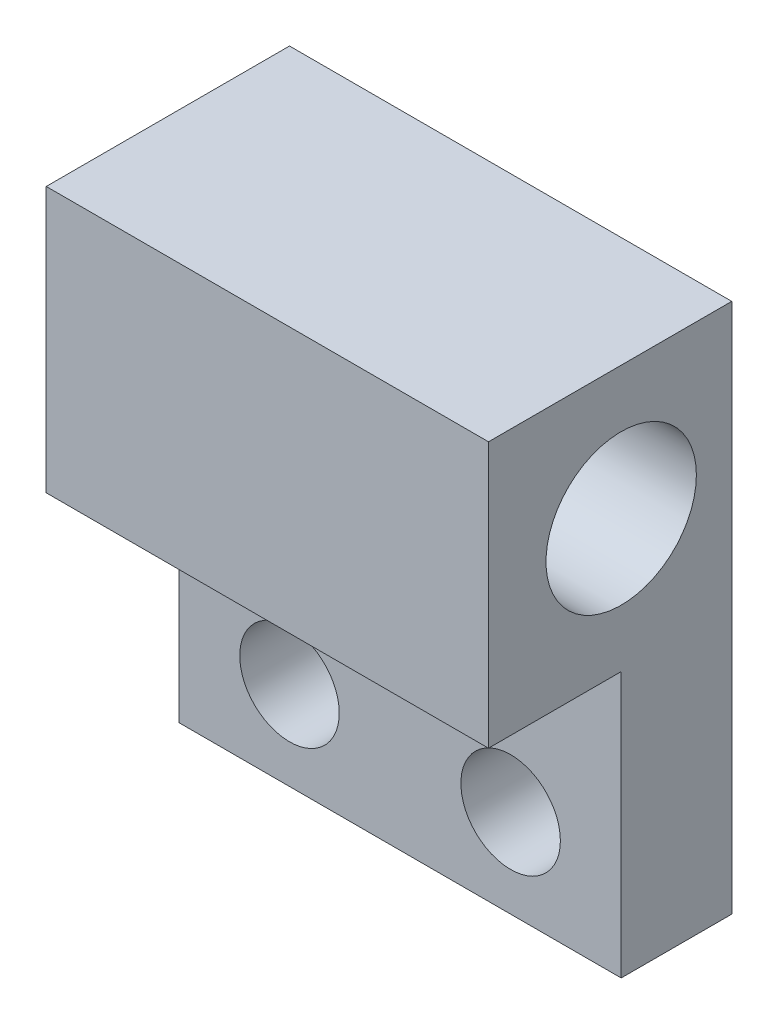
SolidWorks part; units mm, degrees
ref_plane "Piano frontale" through (0, 0, 0) normal (0, 0, 1) x (1, 0, 0)
ref_plane "Piano superiore" through (0, 0, 0) normal (0, 1, 0) x (1, 0, 0)
ref_plane "Piano destro" through (0, 0, 0) normal (1, 0, 0) x (0, 0, -1)
sketch "Schizzo1" plane through (0, 0, 0) normal (0, 0, 1) x (1, 0, 0)
  line L1 (-10, 6) -> (10, 6)
  line L2 (-10, 6) -> (-10, -6)
  line L3 (-10, -6) -> (10, -6)
  line L4 (10, 6) -> (10, -6)
  line L5 (-10, 6) -> (10, -6) construction
  line L6 (-10, -6) -> (10, 6) construction
  point P0 (0, 0)
  dimension "D1" = 20
  dimension "D2" = 12
extrude "Estrusione-Estrusione1" add sketch "Schizzo1" along normal blind 11
sketch "Schizzo2" plane through (0, -6, 0) normal (0, -1, 0) x (-1, 0, 0)
  line L0 (-10, -11) -> (-10, 0) construction
  line L1 (10, 0) -> (-10, 0)
  line L2 (10, 0) -> (10, -5)
  line L3 (10, -5) -> (-10, -5)
  line L4 (-10, 0) -> (-10, -5)
  dimension "D1" = 5
extrude "Estrusione-Estrusione2" add sketch "Schizzo2" along normal blind 12
sketch "Schizzo3" plane through (0, 0, 5) normal (0, 0, 1) x (1, 0, 0)
  line L0 (0, 3.3548) -> (0, -19.0699) construction
  line L2 (10, -18) -> (-10, -18) construction
  circle A0 centre (-5, -14) radius 3.3
  circle A1 centre (5, -14) radius 3.3
extrude "Taglio-Estrusione1" [suppressed] cut sketch "Schizzo3" against normal up to next
hole_wizard "Foro per Vite M4-1" positions "Schizzo4" profile "Schizzo5" hole size "M4" standard "ISO"
sketch "Schizzo4" plane through (0, 0, 5) normal (0, 0, 1) x (1, 0, 0)
  line L0 (10, -18) -> (-10, -18) construction
  line L1 (-10, -18) -> (-10, -6) construction
  point P0 (-5, -14)
  point P2 (5, -14)
  dimension "D1" = 10
  dimension "D2" = 4
  dimension "D3" = 5
sketch "Schizzo5" plane through (-5, -14, 5) normal (1, 0, 0) x (0, -1, 0)
  line L0 (0, 0) -> (0, 5)
  line L1 (0, 5) -> (2.25, 5)
  line L2 (2.25, 5) -> (2.25, 0)
  line L5 (2.25, 0) -> (0, 0)
  line L11 (0, -6.35) -> (0, 107.95) construction
  dimension "Thru Hole Dia." = 4.5
  dimension "Thru Hole Depth" = 5
hole_wizard "Foro filettato M8-1" positions "Schizzo6" profile "Schizzo7" tap size "M8" standard "ISO"
sketch "Schizzo6" plane through (10, 0, 0) normal (1, 0, 0) x (0, 0, -1)
  point P0 (-5, 0)
  dimension "D1" = 5
sketch "Schizzo7" plane through (10, 0, 5) normal (0, 1, 0) x (0, 0, -1)
  line L0 (0, 0) -> (0, 20)
  line L1 (0, 20) -> (3.4, 20)
  line L2 (3.4, 20) -> (3.4, 0)
  line L5 (3.4, 0) -> (0, 0)
  line L11 (0, -6.35) -> (0, 107.95) construction
  dimension "Thru Tap Drill Dia." = 6.8
  dimension "Thru Tap Drill Depth" = 20
equation "\"D1@Schizzo3\"=6+0.1*6"
